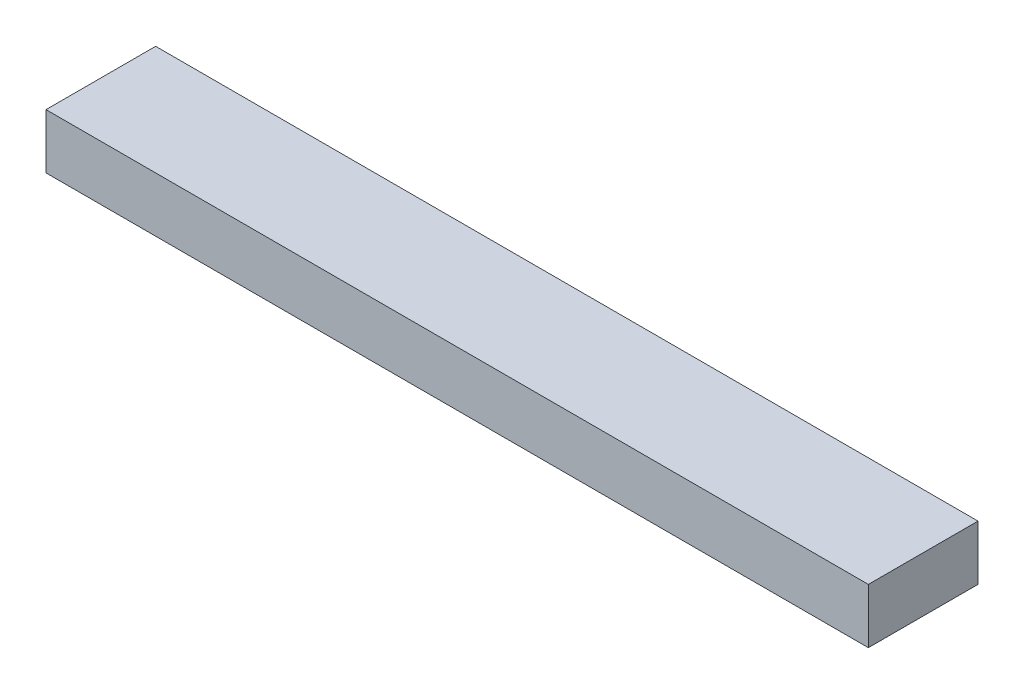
SolidWorks part; units mm, degrees
ref_plane "Front Plane" through (0, 0, 0) normal (0, 0, 1) x (1, 0, 0)
ref_plane "Top Plane" through (0, 0, 0) normal (0, 1, 0) x (1, 0, 0)
ref_plane "Right Plane" through (0, 0, 0) normal (1, 0, 0) x (0, 0, -1)
sketch "Sketch1" plane through (0, 0, 0) normal (1, 0, 0) x (0, 0, -1)
  line L1 (-50, -25) -> (50, -25)
  line L2 (-50, -25) -> (-50, 25)
  line L3 (-50, 25) -> (50, 25)
  line L4 (50, -25) -> (50, 25)
  line L5 (-50, -25) -> (50, 25) construction
  line L6 (-50, 25) -> (50, -25) construction
  point P0 (0, 0)
  dimension "D1" = 50
  dimension "D2" = 100
extrude "Boss-Extrude1" add sketch "Sketch1" along normal blind 750
